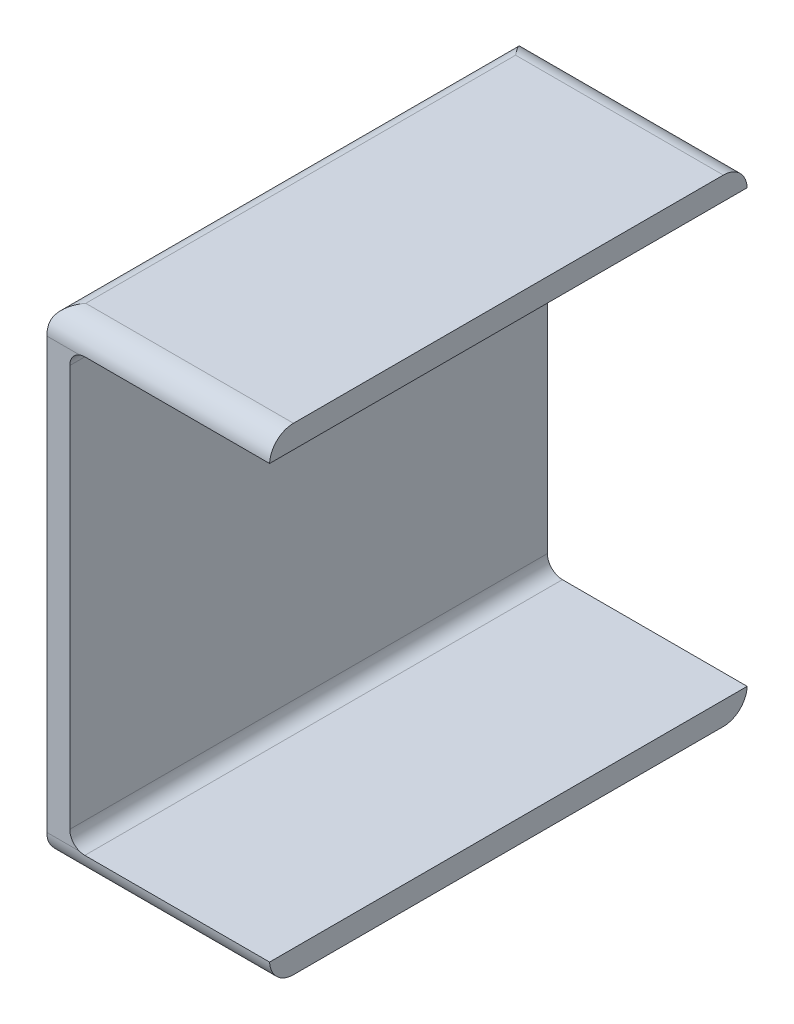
SolidWorks part; units mm, degrees
ref_plane "Front Plane" through (0, 0, 0) normal (0, 0, 1) x (1, 0, 0)
ref_plane "Top Plane" through (0, 0, 0) normal (0, 1, 0) x (1, 0, 0)
ref_plane "Right Plane" through (0, 0, 0) normal (1, 0, 0) x (0, 0, -1)
sketch "Sketch1" plane through (0, 0, 0) normal (0, 0, 1) x (1, 0, 0)
  line L24 (0, 60.452) -> (0, 63.5)
  line L25 (0, 63.5) -> (-27.6125, 63.5)
  line L26 (-29.6125, 61.5) -> (-29.6125, 2)
  line L27 (-27.6125, 0) -> (0, 0)
  line L28 (0, 0) -> (0, 3.048)
  line L29 (0, 3.048) -> (-24.5645, 3.048)
  line L30 (-26.5645, 5.048) -> (-26.5645, 58.452)
  line L31 (-24.5645, 60.452) -> (0, 60.452)
  arc A12 (-27.6125, 63.5) -> (-29.6125, 61.5) centre (-27.6125, 61.5) ccw
  arc A13 (-29.6125, 2) -> (-27.6125, 0) centre (-27.6125, 2) ccw
  arc A14 (-26.5645, 5.048) -> (-24.5645, 3.048) centre (-24.5645, 5.048) ccw
  arc A15 (-24.5645, 60.452) -> (-26.5645, 58.452) centre (-24.5645, 58.452) ccw
extrude "Boss-Extrude1" add sketch "Sketch1" along normal blind 63.5
sketch "Sketch2" plane through (0, 0, 0) normal (1, 0, 0) x (0, 0, -1)
  line L0 (-3.175, 63.5) -> (0, 63.5)
  line L1 (-63.5, 63.5) -> (0, 63.5) construction
  line L2 (0, 63.5) -> (0, 60.325)
  line L4 (-3.175, 0) -> (0, 0)
  line L5 (-63.5, 0) -> (0, 0) construction
  line L6 (0, 0) -> (0, 3.175)
  line L7 (0, 0) -> (0, 3.048) construction
  line L8 (-60.325, 0) -> (-63.5, 0)
  line L9 (-63.5, 0) -> (-63.5, 3.048) construction
  line L10 (-63.5, 0) -> (-63.5, 3.175)
  line L11 (-63.5, 60.325) -> (-63.5, 63.5)
  line L12 (-63.5, 63.5) -> (-60.325, 63.5)
  line L13 (-63.5, 60.452) -> (-63.5, 63.5) construction
  line L14 (0, 60.452) -> (0, 63.5) construction
  arc A0 (0, 60.325) -> (-3.175, 63.5) centre (-3.175, 60.325) ccw
  arc A1 (-3.175, 0) -> (0, 3.175) centre (-3.175, 3.175) ccw
  arc A2 (-63.5, 3.175) -> (-60.325, 0) centre (-60.325, 3.175) ccw
  arc A3 (-60.325, 63.5) -> (-63.5, 60.325) centre (-60.325, 60.325) ccw
  arc A4 (0, 60.325) -> (-3.175, 63.5) centre (-3.175, 60.325) ccw construction
  point P25 (-61.8723, 0)
  point P31 (-61.5592, 0)
extrude "Cut-Extrude1" cut sketch "Sketch2" against normal through all both and the other way through all
